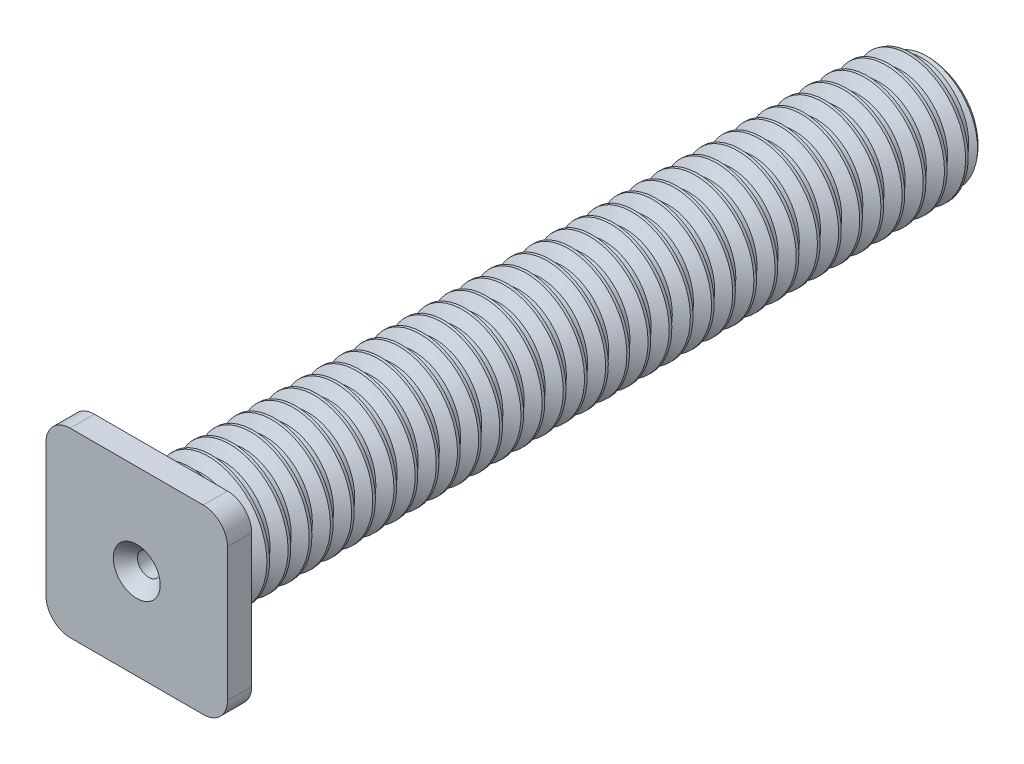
SolidWorks part; units mm, degrees
ref_plane "Спереди" through (0, 0, 0) normal (0, 0, 1) x (1, 0, 0)
ref_plane "Сверху" through (0, 0, 0) normal (0, 1, 0) x (1, 0, 0)
ref_plane "Справа" through (0, 0, 0) normal (1, 0, 0) x (0, 0, -1)
sketch "Эскиз1" plane through (0, 0, 0) normal (0, 0, 1) x (1, 0, 0)
  circle A0 centre (0, 0) radius 10
  dimension "D1" = 20
extrude "Бобышка-Вытянуть1" add sketch "Эскиз1" along normal blind 128
sketch "Эскиз2" plane through (0, 0, 128) normal (0, 0, 1) x (1, 0, 0)
  line L1 (-15, -15) -> (15, -15)
  line L2 (-15, -15) -> (-15, 15)
  line L3 (-15, 15) -> (15, 15)
  line L4 (15, -15) -> (15, 15)
  line L5 (-15, -15) -> (15, 15) construction
  line L6 (-15, 15) -> (15, -15) construction
  point P0 (0, 0)
  dimension "D1" = 30
extrude "Бобышка-Вытянуть2" add sketch "Эскиз2" along normal blind 4
fillet "Скругление1" radius 4 4 edges at (-15, -15, 130) (-15, 15, 130) (15, -15, 130) (15, 15, 130)
fillet "Скругление2" radius 5 1 edges at (10, 0, 0)
thread "Резьба1" start angle 0, offset 7, length 124, pitch 3.5, diameter 20
ref_plane "Плоскость2" through (10, 0, -2) normal (0, -1, 0) x (1, 0, 0)
sketch "Профиль резьбы2" plane through (10, 0, -2) normal (0, -1, 0) x (1, 0, 0)
  line L0 (0, 0) -> (0, 3.5) construction
  line L11 (0, 0) -> (0, 3.0625)
  line L12 (0, 3.0625) -> (-1.8944, 1.9687)
  line L13 (-1.8944, 1.9687) -> (-1.8944, 1.0937)
  line L15 (-1.8944, 1.0937) -> (0, 0)
  line L17 (-1.8944, 1.5312) -> (0, 1.5312) construction
  point P2 (0, 0)
  dimension "Pitch" = 3.5
  dimension "Profile_Angle" = 60
  dimension "Profile_Land" = 0.875
  dimension "Profile_Height" = 1.8944
sketch "Эскиз3" plane through (0, 0, 132) normal (0, 0, 1) x (1, 0, 0)
  circle A0 centre (0, 0) radius 1.875
  dimension "D1" = 3.75
extrude "Вырез-Вытянуть1" cut sketch "Эскиз3" against normal blind 50
chamfer "Фаска1" distance 2 angle 45 1 edges at (1.875, 0, 132)
